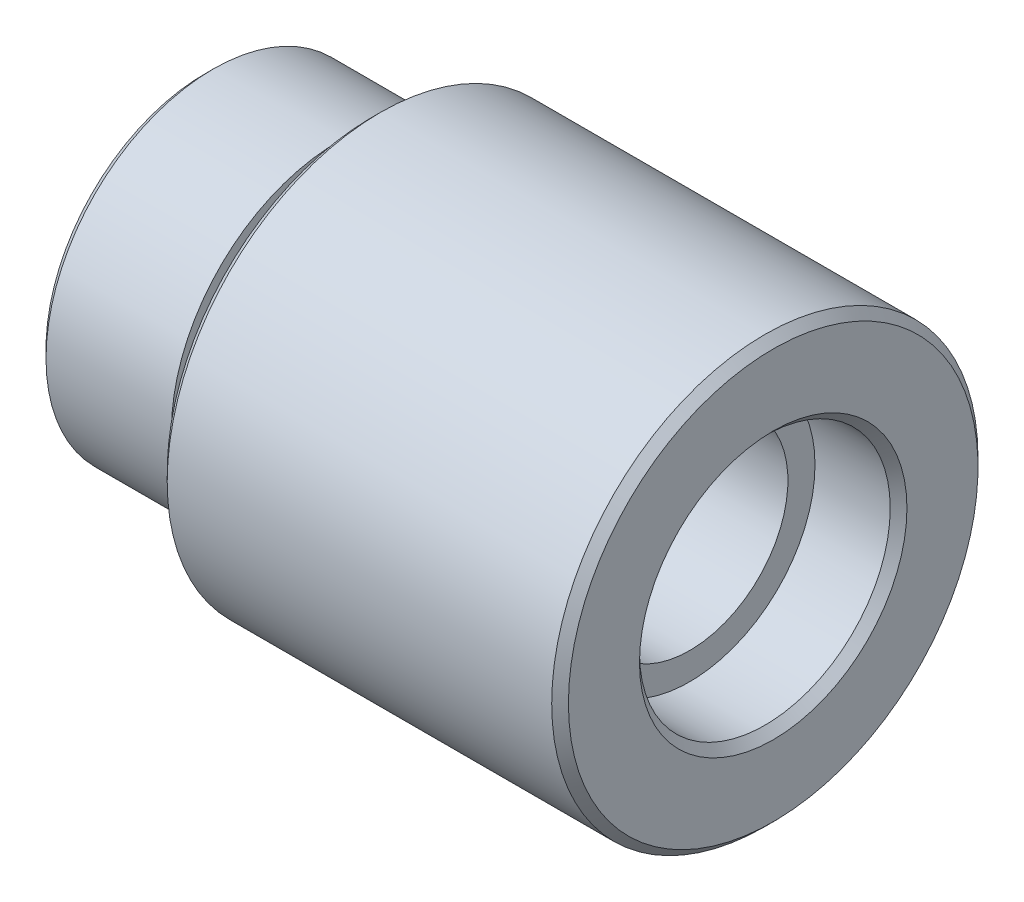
SolidWorks part; units mm, degrees
ref_plane "Plan1" through (0, 0, 0) normal (0, 0, 1) x (1, 0, 0)
ref_plane "Plan2" through (0, 0, 0) normal (0, 1, 0) x (1, 0, 0)
ref_plane "Plan3" through (0, 0, 0) normal (1, 0, 0) x (0, 0, -1)
sketch "Esquisse1" plane through (0, 0, 0) normal (0, 0, 1) x (1, 0, 0)
  line L0 (0, 0) -> (50, 0) construction
  line L1 (0, 7.5) -> (5, 7.5)
  line L2 (34, 7.5) -> (34, 12.75)
  line L3 (34, 12.75) -> (10, 12.75)
  line L4 (10, 12.75) -> (10, 9.25)
  line L5 (10, 9.25) -> (8, 9.25)
  line L6 (8, 9.25) -> (8, 10)
  line L7 (8, 10) -> (0, 10)
  line L8 (0, 10) -> (0, 7.5)
  line L9 (5, 7.5) -> (5, 5.88)
  line L10 (5, 5.88) -> (29, 5.88)
  line L11 (29, 5.88) -> (29, 7.5)
  line L12 (29, 7.5) -> (34, 7.5)
  dimension "D1" = 12.75
  dimension "D2" = 9.25
  dimension "D3" = 10
  dimension "D4" = 34
  dimension "D5" = 24
  dimension "D6" = 8
  dimension "D7" = 7.5
  dimension "D8" = 5.88
  dimension "D9" = 5
  dimension "D10" = 5
revolve "Base-Révolution" add sketch "Esquisse1"
chamfer "Chanfrein1" distance 0.5 angle 45 5 edges at (10, 0, 12.75) (0, 0, 10) (0, 0, 7.5) (34, 0, 7.5) (34, 0, 12.75)
sketch "Esquisse2" plane through (0, 0, 0) normal (0, 0, 1) x (1, 0, 0)
  line L4 (29, 0) -> (5, 0) construction
  point P6 (17, 0)
sketch "Esq_WRNL_Compact001" plane through (0, 0, 0) normal (0, 0, 1) x (1, 0, 0)
  line L0 (-1, -13.75) -> (-1, 13.75)
  line L1 (35, -13.75) -> (35, 13.75)
  line L2 (-1, -13.75) -> (35, -13.75)
  line L3 (-1, 13.75) -> (35, 13.75)
